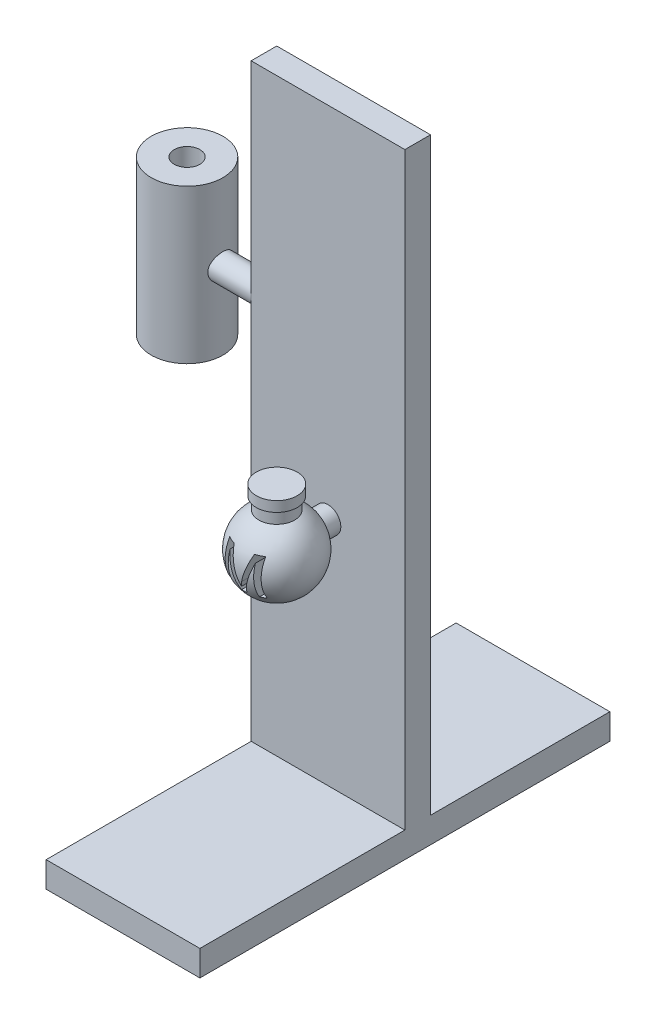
SolidWorks part; units mm, degrees
ref_plane "Face" through (0, 0, 0) normal (0, 0, 1) x (1, 0, 0)
ref_plane "Dessus" through (0, 0, 0) normal (0, 1, 0) x (1, 0, 0)
ref_plane "Droite" through (0, 0, 0) normal (1, 0, 0) x (0, 0, -1)
sketch "Esquisse1" plane through (0, 0, 0) normal (0, 0, 1) x (1, 0, 0)
  line L1 (0, 0) -> (30, 0)
  line L2 (0, 0) -> (0, 120)
  line L3 (0, 120) -> (30, 120)
  line L4 (30, 0) -> (30, 120)
  dimension "D1" = 120
  dimension "D2" = 30
extrude "Base-Extrusion" add sketch "Esquisse1" along normal blind 5
sketch "Esquisse2" plane through (0, 0, 5) normal (0, 0, 1) x (1, 0, 0)
  line L0 (0, 120) -> (0, 0) construction
  line L1 (0, 0) -> (30, 0) construction
  circle A0 centre (15, 50) radius 2.5
  dimension "D1" = 5
  dimension "D2" = 15
  dimension "D3" = 50
extrude "Boss.-Extru.1" add sketch "Esquisse2" along normal blind 10
sketch "Esquisse3" plane through (0, 0, 15) normal (0, 0, 1) x (1, 0, 0)
  line L0 (15, 68.0723) -> (15, 32.5971) construction
  line L1 (15, 42.5) -> (15, 57.5)
  arc A0 (15, 57.5) -> (15, 42.5) centre (15, 50) ccw
  circle A1 centre (15, 50) radius 2.5 construction
  dimension "D1" = 15
revolve "Boss.-Révol.1" add sketch "Esquisse3" angle 360 about L0
ref_plane "Plan1" through (0, 50, 0) normal (0, -1, 0) x (1, 0, 0)
sketch "Esquisse4" plane through (0, 50, 0) normal (0, -1, 0) x (1, 0, 0)
  circle A0 centre (15, 15) radius 3.5
  arc A1 (17.5, 7.9289) -> (12.5, 7.9289) centre (15, 15) ccw construction
  dimension "D1" = 7
extrude "Boss.-Extru.2" add sketch "Esquisse4" against normal blind 9
sketch "Esquisse5" plane through (0, 59, 0) normal (0, 1, 0) x (-1, 0, 0)
  circle A0 centre (-15, 15) radius 4
  dimension "D1" = 8
extrude "Boss.-Extru.3" add sketch "Esquisse5" along normal blind 2
sketch "Esquisse6" plane through (0, 0, 0) normal (-1, 0, 0) x (0, 0, 1)
  line L0 (0, 120) -> (0, 0) construction
  circle A0 centre (2.5, 80) radius 2.5
  dimension "D1" = 5
  dimension "D2" = 2.5
  dimension "D3" = 80
extrude "Boss.-Extru.4" add sketch "Esquisse6" along normal blind 15
ref_plane "Plan2" through (0, 0, 2.5) normal (0, 0, 1) x (1, 0, 0)
sketch "Esquisse7" plane through (0, 0, 2.5) normal (0, 0, 1) x (1, 0, 0)
  line L0 (-15, 101.071) -> (-15, 46.0174) construction
  line L1 (-15, 82.5) -> (-15, 77.5) construction
  line L2 (0, 82.5) -> (-15, 82.5) construction
  line L3 (-15, 95) -> (-8, 95)
  line L4 (-15, 95) -> (-15, 65)
  line L5 (-15, 65) -> (-8, 65)
  line L6 (-8, 95) -> (-8, 65)
  dimension "D1" = 30
  dimension "D2" = 12.5
  dimension "D3" = 14
revolve "Boss.-Révol.2" add sketch "Esquisse7" angle 360 about L0
sketch "Esquisse9" plane through (0, 0, 5) normal (0, 0, 1) x (1, 0, 0)
  line L0 (30, 0) -> (30, 120) construction
  line L1 (0, 0) -> (30, 0)
  line L2 (0, 0) -> (0, 5)
  line L3 (0, 5) -> (30, 5)
  line L4 (30, 0) -> (30, 5)
  dimension "D1" = 5
extrude "Boss.-Extru.6" add sketch "Esquisse9" along normal blind 40 and the other way blind 40
sketch "Esquisse10" plane through (0, 95, 0) normal (0, 1, 0) x (-1, 0, 0)
  circle A0 centre (15, 2.5) radius 2.5
  dimension "D1" = 5
extrude "Enlèv. mat.-Extru.1" cut sketch "Esquisse10" against normal blind 33
ref_plane "Plan3" through (0, 0, 17) normal (0, 0, 1) x (1, 0, 0)
sketch "Esquisse11" plane through (0, 0, 17) normal (0, 0, 1) x (1, 0, 0)
  text T0 "M" font "Arial" height in points 28
extrude "Enlèv. mat.-Extru.2" cut sketch "Esquisse11" along normal blind 18.5768
